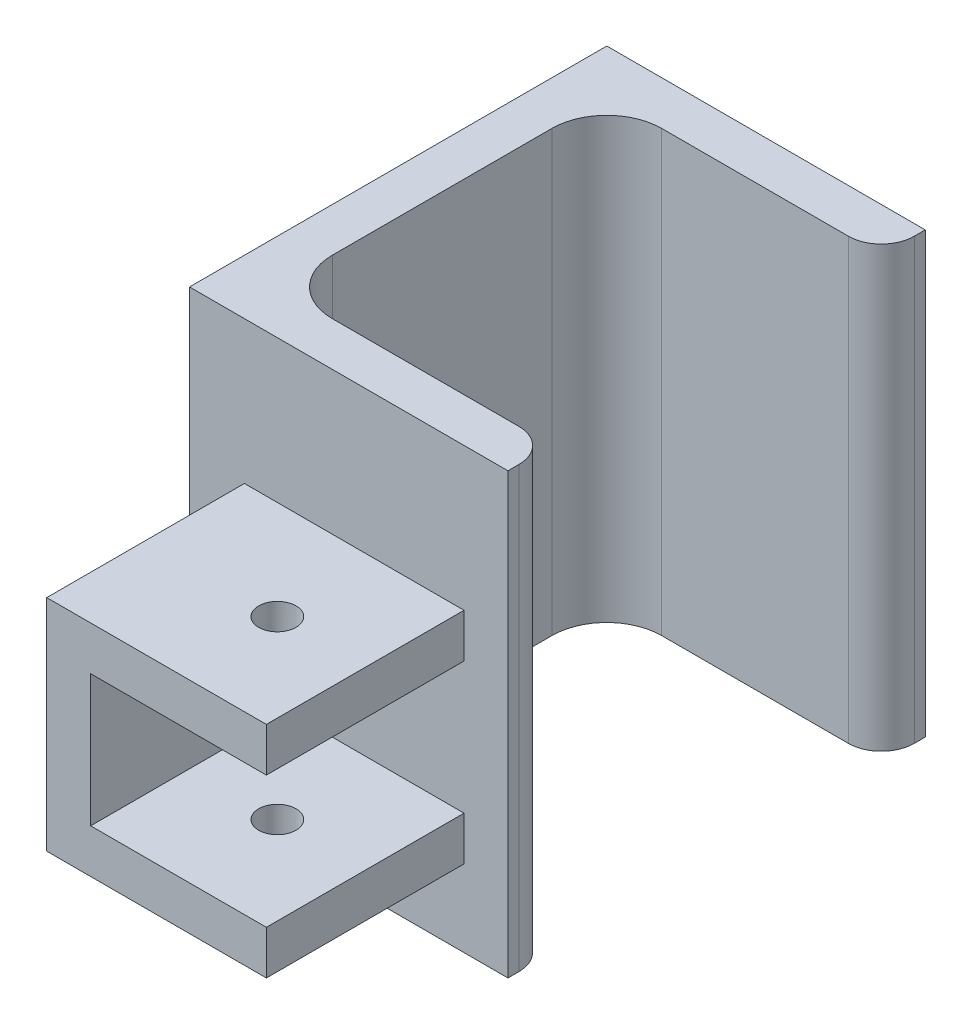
SolidWorks part; units mm, degrees
ref_plane "Front Plane" through (0, 0, 0) normal (0, 0, 1) x (1, 0, 0)
ref_plane "Top Plane" through (0, 0, 0) normal (0, 1, 0) x (1, 0, 0)
ref_plane "Right Plane" through (0, 0, 0) normal (1, 0, 0) x (0, 0, -1)
sketch "Sketch4" plane through (0, 0, 0) normal (1, 0, 0) x (0, 0, -1)
  line L1 (-15, 20) -> (15, 20)
  line L2 (-15, 20) -> (-15, -20)
  line L3 (-15, -20) -> (15, -20)
  line L4 (15, 20) -> (15, -20)
  line L5 (-15, 20) -> (15, -20) construction
  line L6 (-15, -20) -> (15, 20) construction
  point P0 (0, 0)
  dimension "D1" = 40
  dimension "D2" = 30
extrude "Boss-Extrude2" add sketch "Sketch4" along normal blind 4
sketch "Sketch5" plane through (0, 0, 15) normal (0, 0, 1) x (1, 0, 0)
  line L1 (0, 20) -> (29, 20)
  line L2 (0, 20) -> (0, -20)
  line L3 (0, -20) -> (29, -20)
  line L4 (29, 20) -> (29, -20)
  dimension "D1" = 29
  dimension "D2" = 40
extrude "Boss-Extrude3" add sketch "Sketch5" along normal blind 4
sketch "Sketch6" plane through (0, 0, -15) normal (0, 0, -1) x (-1, 0, 0)
  line L1 (0, 20) -> (-29, 20)
  line L2 (0, 20) -> (0, -20)
  line L3 (0, -20) -> (-29, -20)
  line L4 (-29, 20) -> (-29, -20)
extrude "Boss-Extrude4" add sketch "Sketch6" along normal blind 4
fillet "Fillet1" radius 5 2 edges at (4, 0, 15) (4, 0, -15)
fillet "Fillet2" radius 3 2 edges at (29, 0, 15) (29, 0, -15)
sketch "Sketch8" plane through (0, 0, 19) normal (0, 0, 1) x (1, 0, 0)
  line L0 (0, -20) -> (29, -20) construction
  line L1 (5, 7) -> (25, 7)
  line L2 (5, 7) -> (5, -13)
  line L3 (5, -13) -> (25, -13)
  line L4 (25, 7) -> (25, -13)
  line L5 (0, 20) -> (0, -20) construction
  dimension "D1" = 20
  dimension "D2" = 20
  dimension "D3" = 7
  dimension "D4" = 5
extrude "Boss-Extrude5" add sketch "Sketch8" along normal blind 18
sketch "Sketch9" plane through (0, 0, 37) normal (0, 0, 1) x (1, 0, 0)
  line L0 (25, -13) -> (25, 7) construction
  line L1 (9, 3) -> (25, 3)
  line L2 (9, 3) -> (9, -9)
  line L3 (9, -9) -> (25, -9)
  line L4 (25, 3) -> (25, -9)
  line L5 (25, 7) -> (5, 7) construction
  line L6 (5, -13) -> (25, -13) construction
  line L7 (5, 7) -> (5, -13) construction
  dimension "D1" = 4
  dimension "D2" = 4
  dimension "D3" = 4
extrude "Cut-Extrude1" cut sketch "Sketch9" against normal blind 18
sketch "Sketch10" plane through (0, -13, 0) normal (0, -1, 0) x (1, 0, 0)
  line L1 (5, 37) -> (25, 37) construction
  line L2 (25, 37) -> (25, 19) construction
  circle A0 centre (17, 28) radius 1.7
  dimension "D1" = 3.4
  dimension "D2" = 8
  dimension "D3" = 9
extrude "Cut-Extrude2" cut sketch "Sketch10" against normal through all
equation "\"Bearing_OD\"= 10mm"
equation "\"Bearing_ID\"= 5mm"
equation "\"Bearing_Width\"= 4mm"
equation "\"M3_Clearance\"= 3.3mm"
equation "\"Wall\"= 3mm"
equation "\"Thumb_Length\"= 70mm"
equation "\"Proximal_Length\"= 42mm"
equation "\"Distal_Length\"= 28mm"
